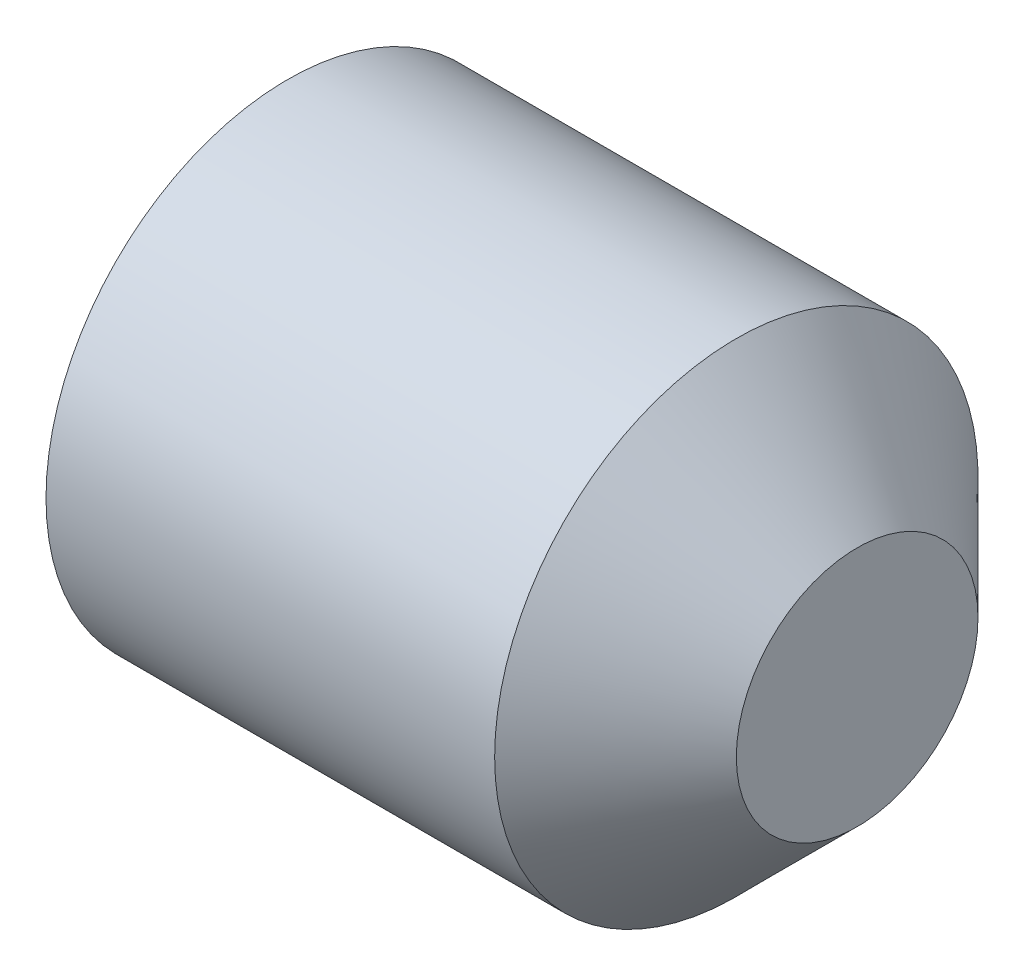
SolidWorks part; units mm, degrees
ref_plane "Front Plane" through (0, 0, 0) normal (0, 0, 1) x (1, 0, 0)
ref_plane "Top Plane" through (0, 0, 0) normal (0, 1, 0) x (1, 0, 0)
ref_plane "Right Plane" through (0, 0, 0) normal (1, 0, 0) x (0, 0, -1)
sketch "BodySke" plane through (0, 0, 0) normal (0, 0, 1) x (1, 0, 0)
  line L0 (0, 0) -> (3.28, 0) construction
  line L1 (2, 0) -> (2, 0.4)
  line L2 (2, 0.4) -> (1.6, 0.8)
  line L3 (1.6, 0.8) -> (0, 0.8)
  line L4 (0, 0.8) -> (0, 0)
  line L5 (0, 0) -> (2, 0)
  line L6 (1.65, 1.0236) -> (1.65, -0.6432) construction
  point P5 (0, 0.601)
  dimension "Diameter" = 1.6
  dimension "Length" = 2
  dimension "Chamfer_End" = 0.8
  dimension "Angle" = 135
  dimension "Minor_dia" = 1.202
  dimension "Advance" = 0.35
revolve "BaseBody" add sketch "BodySke" angle 360 about L0
sketch "HeadChamferSke" plane through (0, 0, 0) normal (0, 0, 1) x (1, 0, 0)
  line L0 (0, 0) -> (2.4505, 0) construction
  line L1 (0, 0.8) -> (0, 0.601)
  line L2 (0, 0.8) -> (0.1149, 0.8)
  line L3 (0.1149, 0.8) -> (0, 0.601)
  line L4 (1.6, 0.8) -> (0, 0.8) construction
  line L5 (0, 0.8) -> (0, -0.8) construction
  line L6 (0, 0.8) -> (0, 0) construction
  dimension "Angle" = 30
revolve "HeadChamfer" cut sketch "HeadChamferSke" angle 360 about L0
sketch "HexagonSocketSke" plane through (0, 0, 0) normal (-1, 0, 0) x (0, 0, 1)
  line L1 (0, 0.4041) -> (-0.35, 0.2021)
  line L2 (-0.35, 0.2021) -> (-0.35, -0.2021)
  line L3 (-0.35, -0.2021) -> (0, -0.4041)
  line L4 (0, -0.4041) -> (0.35, -0.2021)
  line L5 (0.35, -0.2021) -> (0.35, 0.2021)
  line L6 (0.35, 0.2021) -> (0, 0.4041)
  circle A0 centre (0, 0) radius 0.35 construction
  dimension "Hexagon_Width" = 0.7
extrude "HexagonSocket" cut sketch "HexagonSocketSke" against normal blind 0.7
sketch "ThdSchSke" plane through (0, 0, 0) normal (0, 0, 1) x (1, 0, 0)
  line L0 (0, 0) -> (2.6881, 0) construction
  line L1 (0.2351, 1.0298) -> (0.2351, 0.8)
  line L2 (0.2351, 1.0298) -> (0.4649, 1.0298)
  line L3 (0.4649, 1.0298) -> (0.4649, 0.8)
  line L4 (0.4649, 0.8) -> (0.35, 0.601)
  line L5 (0.35, 0.601) -> (0.2351, 0.8)
  line L6 (1.6, 0.8) -> (0.1149, 0.8) construction
  dimension "D1" = 0.35
revolve "ThreadSchematic" [suppressed] cut sketch "ThdSchSke" angle 360 about L0
pattern_linear "ThdSchPat" [suppressed] count 4 along (1, 0, 0)
equation "\"Minor_dia@ThreadCosmetic\" = \"Minor_dia@BodySke\""
equation "\"D1@ThdSchSke\" = \"Advance@BodySke\""
equation "\"Advance@ThdSchPat\" = \"Advance@BodySke\""
equation "\"D1@ThdSchPat\" =  int( ( \"Length@BodySke\" -  ( \"Diameter@BodySke\" / 2 - \"Chamfer_End@BodySke\" / 2 )  )  / \"Advance@ThdSchPat\" * 0.98  )  "
